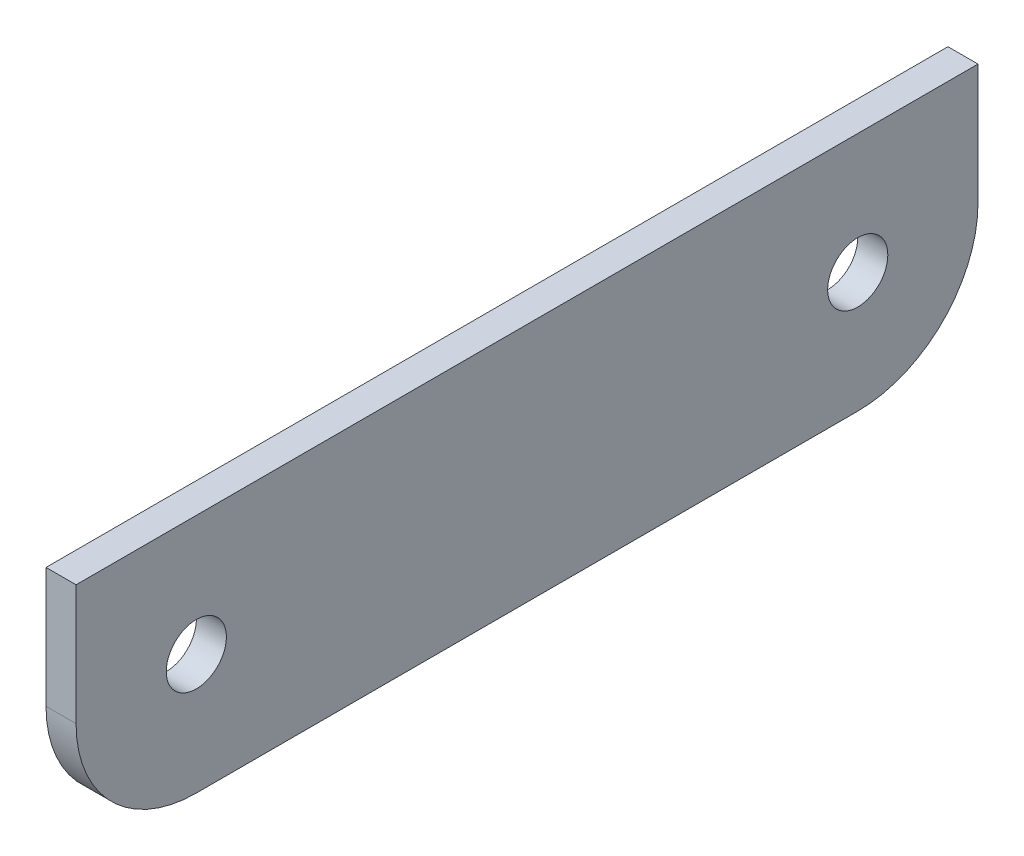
SolidWorks part; units mm, degrees
ref_plane "Plan de face" through (0, 0, 0) normal (0, 0, 1) x (1, 0, 0)
ref_plane "Plan de dessus" through (0, 0, 0) normal (0, 1, 0) x (1, 0, 0)
ref_plane "Plan de droite" through (0, 0, 0) normal (1, 0, 0) x (0, 0, -1)
sketch "Esquisse1" plane through (0, 0, 0) normal (1, 0, 0) x (0, 0, -1)
  line L0 (44.5246, 0) -> (-7.4016, 0) construction
  line L1 (0, -16.807) -> (0, 24.0876) construction
  line L2 (44.5246, -8) -> (-7.4016, -8) construction
  line L3 (30, 24.0876) -> (30, -16.807) construction
  line L4 (15, 16.6144) -> (15, 4.5645) construction
  line L5 (35.5528, -4) -> (21.0943, -4) construction
  line L6 (26, -11.5109) -> (26, -2.1237) construction
  line L8 (0, 0) -> (30, 0)
  line L9 (0, 0) -> (0, -4)
  line L10 (4, -8) -> (26, -8)
  line L11 (30, 0) -> (30, -4)
  circle A0 centre (26, -4) radius 1
  circle A1 centre (4, -4) radius 1
  arc A2 (0, -4) -> (4, -8) centre (4, -4) ccw
  arc A3 (26, -8) -> (30, -4) centre (26, -4) ccw
  point P27 (30, -8)
  dimension "D6" = 4
  dimension "D1" = 8
  dimension "D2" = 30
  dimension "D3" = 15
  dimension "D4" = 4
  dimension "D5" = 4
extrude "Boss.-Extru.1" add sketch "Esquisse1" along normal blind 1
